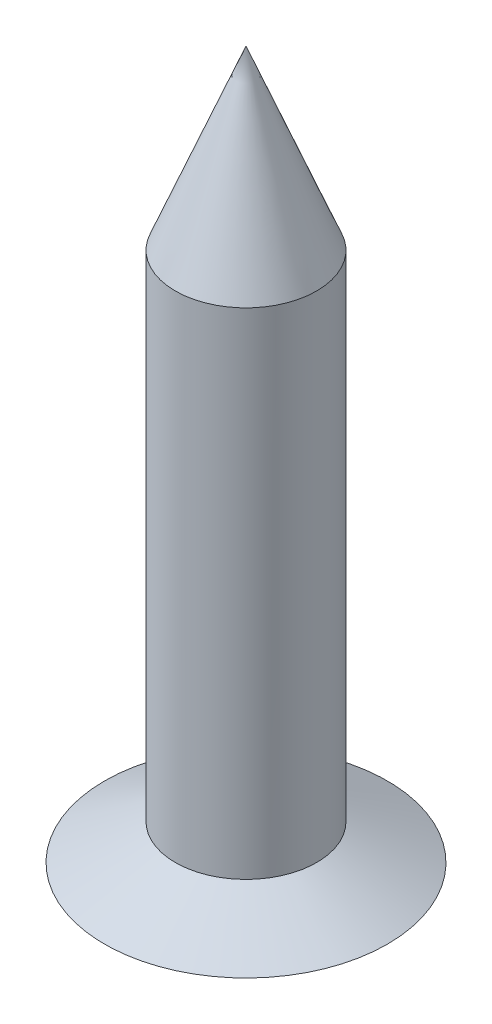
SolidWorks part; units mm, degrees
ref_plane "Alzado" through (0, 0, 0) normal (0, 0, 1) x (1, 0, 0)
ref_plane "Planta" through (0, 0, 0) normal (0, 1, 0) x (1, 0, 0)
ref_plane "Vista lateral" through (0, 0, 0) normal (1, 0, 0) x (0, 0, -1)
sketch "Croquis1" plane through (0, 0, 0) normal (0, 0, 1) x (1, 0, 0)
  line L0 (0, 0) -> (4, 0)
  line L1 (4, 0) -> (2, 1)
  line L2 (2, 1) -> (2, 15)
  line L3 (2, 15) -> (0, 20)
  line L4 (0, 20) -> (0, 0)
  dimension "D1" = 2
  dimension "D2" = 1
  dimension "D3" = 4
  dimension "D4" = 20
  dimension "D5" = 5
revolve "Revolución1" add sketch "Croquis1" angle 360 about L4
